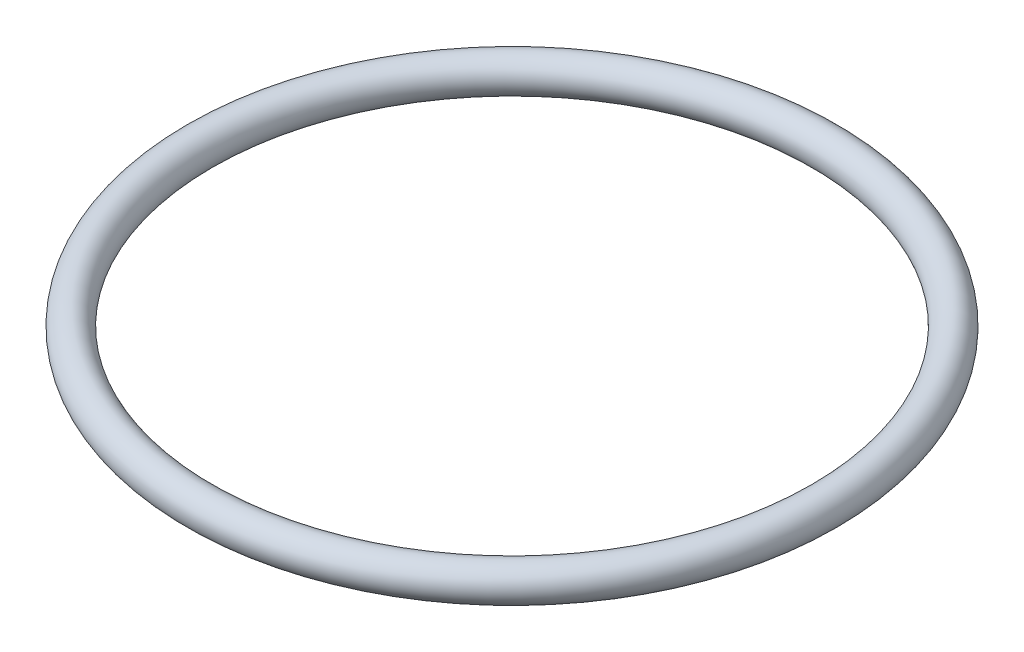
SolidWorks part; units mm, degrees
ref_plane "Face" through (0, 0, 0) normal (0, 0, 1) x (1, 0, 0)
ref_plane "Dessus" through (0, 0, 0) normal (0, 1, 0) x (1, 0, 0)
ref_plane "Droite" through (0, 0, 0) normal (1, 0, 0) x (0, 0, -1)
sketch "Esquisse1" plane through (0, 0, 0) normal (0, 0, 1) x (1, 0, 0)
  line L0 (0, 65.18) -> (0, 81.5801) construction
  arc A2 (15.825, 63.4) -> (15.825, 65.18) centre (15.825, 64.29) ccw
  arc A3 (15.825, 65.18) -> (15.825, 63.4) centre (15.825, 64.29) ccw
  dimension "D1" = 1.78
  dimension "D2" = 29.87
revolve "Révolution1" add sketch "Esquisse1" angle 360 about L0
